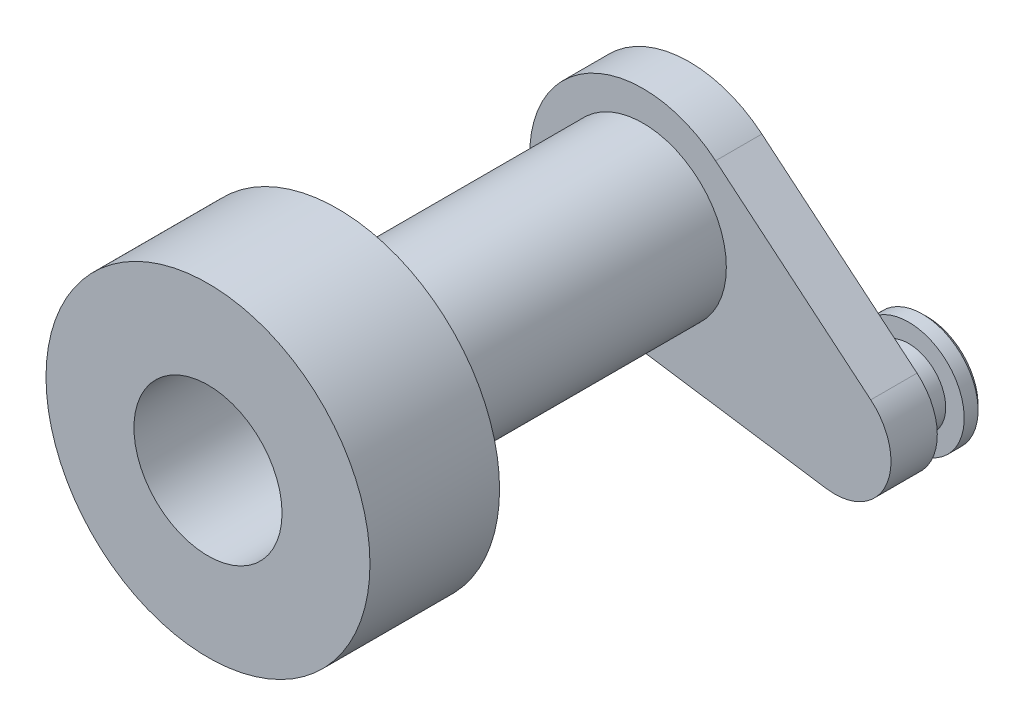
SolidWorks part; units mm, degrees
ref_plane "Plan1" through (0, 0, 0) normal (0, 0, 1) x (1, 0, 0)
ref_plane "Plan2" through (0, 0, 0) normal (0, 1, 0) x (1, 0, 0)
ref_plane "Plan3" through (0, 0, 0) normal (1, 0, 0) x (0, 0, -1)
sketch "Esquisse1" plane through (0, 0, 0) normal (0, 0, 1) x (1, 0, 0)
  circle A26 centre (353.5953, 142.141) radius 16.5726
sketch "Esquisse2" plane through (0, 0, 0) normal (0, 0, 1) x (1, 0, 0)
  circle A0 centre (353.5953, 142.141) radius 17.5
  dimension "D1" = 35
extrude "Base-Extrusion" add sketch "Esquisse2" against normal blind 14
sketch "Esquisse3" plane through (0, 0, -14) normal (0, 0, -1) x (-1, 0, 0)
  circle A0 centre (-353.5953, 142.141) radius 9
  dimension "D1" = 18
extrude "Boss.-Extru.1" add sketch "Esquisse3" along normal blind 38
sketch "Esquisse4" plane through (0, 0, 0) normal (0, 0, 1) x (1, 0, 0)
  circle A0 centre (353.5953, 142.141) radius 8
  dimension "D1" = 16
extrude "Enlèv. mat.-Extru.1" cut sketch "Esquisse4" against normal through all
sketch "Esquisse5" plane through (839.9098, -92.077, -52) normal (0, 0, -1) x (-1, 0, 0)
  line L0 (461.713, 229.6243) -> (478.4752, 243.6121)
  line L1 (466.506, 218.9224) -> (488.1032, 222.1141)
  circle A0 centre (486.3144, 234.218) radius 8 construction
  arc A1 (488.1032, 222.1141) -> (478.4752, 243.6121) centre (486.3144, 234.218) ccw
  arc A2 (461.713, 229.6243) -> (466.506, 218.9224) centre (465.6155, 224.9478) ccw
  circle A3 centre (486.3144, 234.218) radius 7.627
  dimension "D2" = 22.68
extrude "Boss.-Extru.2" add sketch "Esquisse5" against normal blind 5
sketch "Esquisse6" plane through (0, 0, -52) normal (0, 0, -1) x (-1, 0, 0)
  circle A0 centre (-374.2943, 132.8708) radius 4
extrude "Boss.-Extru.4" add sketch "Esquisse6" along normal blind 3
sketch "Esquisse7" plane through (0, 0, -55) normal (0, 0, -1) x (-1, 0, 0)
  circle A0 centre (-374.2943, 132.8708) radius 6
  dimension "D1" = 12
extrude "Boss.-Extru.5" add sketch "Esquisse7" along normal blind 2
chamfer "Chanfrein1" distance 0.5 angle 45
